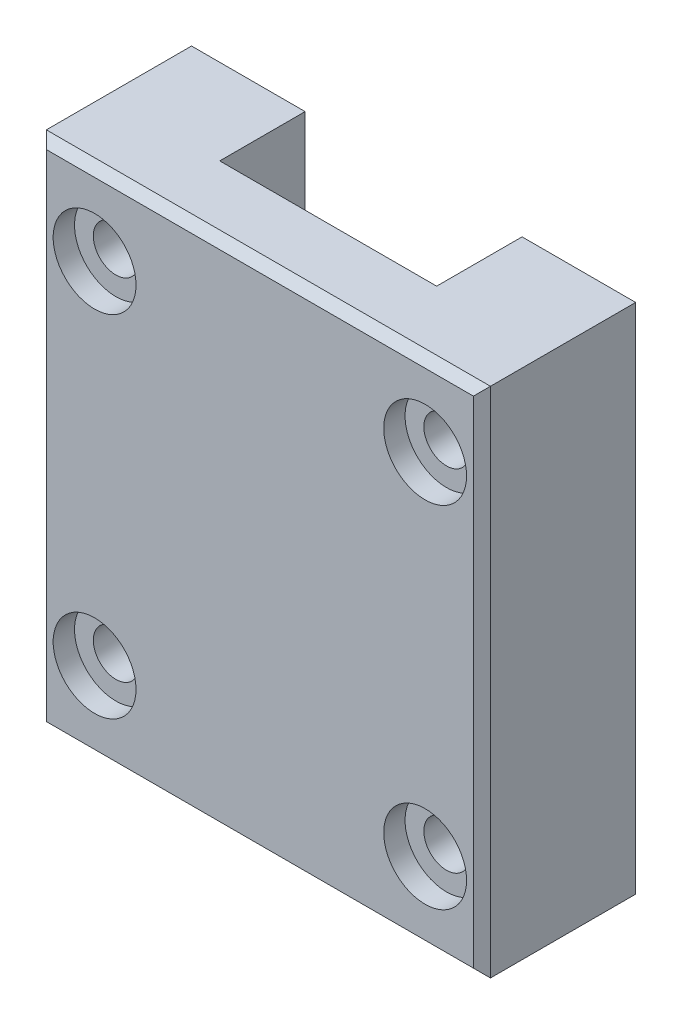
SolidWorks part; units mm, degrees
ref_plane "Спереди" through (0, 0, 0) normal (0, 0, 1) x (1, 0, 0)
ref_plane "Сверху" through (0, 0, 0) normal (0, 1, 0) x (1, 0, 0)
ref_plane "Справа" through (0, 0, 0) normal (1, 0, 0) x (0, 0, -1)
sketch "Эскиз1" plane through (0, 0, 0) normal (0, 0, 1) x (1, 0, 0)
  line L0 (-42, 90) -> (-55.3, 90)
  line L1 (-42, 150) -> (-16.6, 150)
  line L2 (-42, 150) -> (-42, 90) construction
  line L3 (-42, 90) -> (-16.6, 90)
  line L4 (-16.6, 150) -> (-16.6, 90) construction
  line L5 (-55.3, 90) -> (-55.3, 150)
  line L6 (-42, 150) -> (-55.3, 150) construction
  line L7 (-55.3, 150) -> (-42, 150)
  line L8 (-16.6, 90) -> (-3.3, 90)
  line L9 (-3.3, 90) -> (-3.3, 150)
  line L10 (-3.3, 150) -> (-16.6, 150) construction
  line L11 (-3.3, 150) -> (-16.6, 150)
extrude "Бобышка-Вытянуть1" add sketch "Эскиз1" along normal blind 8
sketch "Эскиз2" plane through (0, 0, 0) normal (0, 0, -1) x (-1, 0, 0)
  line L0 (55.3, 90) -> (55.3, 150) construction
  line L1 (3.3, 90) -> (3.3, 150) construction
  line L2 (16.6, 150) -> (16.6, 90) construction
  line L3 (42, 150) -> (42, 90) construction
  line L4 (55.3, 90) -> (55.3, 150)
  line L5 (55.3, 150) -> (3.3, 150)
  line L6 (3.3, 150) -> (3.3, 90)
  line L7 (3.3, 90) -> (55.3, 90)
  line L8 (55.3, 90) -> (55.3, 150)
  line L10 (3.3, 150) -> (3.3, 90)
  line L12 (55.3, 90) -> (55.3, 150)
  line L13 (3.3, 90) -> (3.3, 150)
  line L14 (16.6, 150) -> (16.6, 90)
  line L15 (42, 150) -> (42, 90)
  line L16 (55.3, 150) -> (42, 150)
  line L17 (16.6, 150) -> (3.3, 150)
  line L18 (3.3, 90) -> (16.6, 90)
  line L19 (42, 90) -> (55.3, 90)
  dimension "D1" = 0
extrude "Бобышка-Вытянуть2" add sketch "Эскиз2" along normal blind 10 contours L15 L19 L8 L16 | L14 L18 L10 L17
sketch "Эскиз3" plane through (0, 0, 8) normal (0, 0, 1) x (1, 0, 0)
  circle A0 centre (-48.65, 99.5) radius 2.65 construction
  circle A1 centre (-9.95, 99.5) radius 2.65 construction
  circle A2 centre (-9.95, 140.5) radius 2.65 construction
  circle A3 centre (-48.65, 140.5) radius 2.65 construction
  circle A4 centre (-48.65, 99.5) radius 2.65
  circle A5 centre (-9.95, 99.5) radius 2.65
  circle A6 centre (-9.95, 140.5) radius 2.65
  circle A7 centre (-48.65, 140.5) radius 2.65
extrude "Вырез-Вытянуть1" cut sketch "Эскиз3" against normal through all
chamfer "Фаска1" distance 1 angle 45 4 edges at (-29.3, 90, 8) (-3.3, 120, 8) (-29.3, 150, 8) (-55.3, 120, 8)
sketch "Эскиз4" plane through (0, 0, 8) normal (0, 0, 1) x (1, 0, 0)
  circle A0 centre (-48.65, 140.5) radius 4.85
  circle A1 centre (-48.65, 99.5) radius 4.85
  circle A2 centre (-9.95, 99.5) radius 4.85
  circle A3 centre (-9.95, 140.5) radius 4.85
  dimension "D1" = 9.7
extrude "Вырез-Вытянуть2" cut sketch "Эскиз4" against normal blind 2.5
